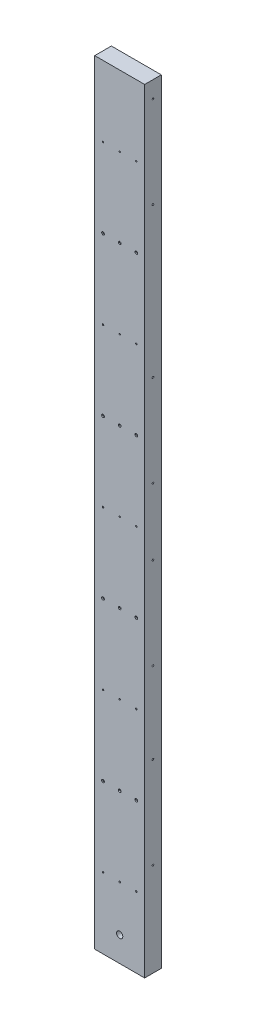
SolidWorks part; units mm, degrees
ref_plane "Front Plane" through (0, 0, 0) normal (0, 0, 1) x (1, 0, 0)
ref_plane "Top Plane" through (0, 0, 0) normal (0, 1, 0) x (1, 0, 0)
ref_plane "Right Plane" through (0, 0, 0) normal (1, 0, 0) x (0, 0, -1)
sketch "Sketch1" plane through (0, 0, 0) normal (0, 1, 0) x (1, 0, 0)
  line L1 (-76.2, 25.4) -> (76.2, 25.4)
  line L2 (-76.2, 25.4) -> (-76.2, -25.4)
  line L3 (-76.2, -25.4) -> (76.2, -25.4)
  line L4 (76.2, 25.4) -> (76.2, -25.4)
  line L5 (-76.2, 25.4) -> (76.2, -25.4) construction
  line L6 (-76.2, -25.4) -> (76.2, 25.4) construction
  point P0 (0, 0)
  dimension "D1" = 152.4
  dimension "D2" = 50.8
extrude "Boss-Extrude1" add sketch "Sketch1" along normal blind 2362.2
hole_wizard "3/4 (0.75) Diameter Slot1" positions "Sketch3" profile "Sketch2" size "3/4" standard "ANSI Inch"
sketch "Sketch3" plane through (0, 0, -25.4) normal (0, 0, -1) x (-1, 0, 0)
  line L0 (-76.2, 0) -> (76.2, 0) construction
  line L1 (76.2, 2362.2) -> (76.2, 0) construction
  point P0 (0, 76.2)
  dimension "D1" = 76.2
  dimension "D2" = 76.2
sketch "Sketch2" plane through (0, 76.2, -25.4) normal (1, 0, 0) x (0, 1, 0)
  line L0 (0, 0) -> (0, 50.8)
  line L1 (0, 50.8) -> (9.525, 50.8)
  line L2 (9.525, 50.8) -> (9.525, 0)
  line L5 (9.525, 0) -> (0, 0)
  line L11 (0, -6.35) -> (0, 107.95) construction
  dimension "Thru Hole Dia." = 19.05
  dimension "Thru Hole Depth" = 50.8
hole_wizard "3/4 (0.75) Diameter Slot2" positions "Sketch5" profile "Sketch4" size "3/4" standard "ANSI Inch"
sketch "Sketch5" plane through (0, 0, -25.4) normal (0, 0, -1) x (-1, 0, 0)
  line L0 (-76.2, 0) -> (76.2, 0) construction
  line L1 (76.2, 2362.2) -> (76.2, 0) construction
  point P0 (0, 76.2)
  dimension "D1" = 76.2
  dimension "D2" = 76.2
sketch "Sketch4" plane through (0, 76.2, -25.4) normal (1, 0, 0) x (0, 1, 0)
  line L0 (0, 0) -> (0, 50.8)
  line L1 (0, 50.8) -> (14.2875, 50.8)
  line L2 (14.2875, 50.8) -> (14.2875, 0)
  line L5 (14.2875, 0) -> (0, 0)
  line L11 (0, -6.35) -> (0, 107.95) construction
  dimension "Thru Hole Dia." = 28.575
  dimension "Thru Hole Depth" = 50.8
hole_wizard "CSK for #8 Flat Head Machine Screw (100)2" positions "Sketch9" profile "Sketch8" countersink size "#8" standard "ANSI Inch"
sketch "Sketch9"
  line L0 (0, 2362.2) -> (0, 0) construction
  line L1 (-76.2, 2362.2) -> (76.2, 2362.2) construction
  line L2 (-76.2, 0) -> (76.2, 0) construction
  line L4 (50.8, 2362.2) -> (50.8, 0) construction
  line L6 (-50.8, 0) -> (-50.8, 2362.2) construction
  line L8 (-76.2, 2362.2) -> (-76.2, 0) construction
  line L9 (76.2, 2362.2) -> (76.2, 0) construction
  line L10 (76.2, 1905) -> (-76.2, 1905) construction
  line L12 (76.2, 1422.4) -> (-76.2, 1422.4) construction
  line L14 (76.2, 939.8) -> (-76.2, 939.8) construction
  line L16 (76.2, 457.2) -> (-76.2, 457.2) construction
  point P0 (50.8, 1905)
  point P2 (0, 1905)
  point P4 (-50.8, 1905)
  point P6 (50.8, 1422.4)
  point P8 (0, 1422.4)
  point P10 (-50.8, 1422.4)
  point P12 (50.8, 939.8)
  point P14 (0, 939.8)
  point P16 (-50.8, 939.8)
  point P18 (50.8, 457.2)
  point P20 (0, 457.2)
  point P22 (-50.8, 457.2)
  dimension "D1" = 25.4
  dimension "D2" = 25.4
  dimension "D3" = 457.2
  dimension "D4" = 939.8
  dimension "D5" = 1422.4
  dimension "D6" = 1905
sketch "Sketch8" plane through (50.8, 1905, 25.4) normal (1, 0, 0) x (0, -1, 0)
  line L0 (0, 0) -> (0, 50.8)
  line L1 (0, 50.8) -> (2.2479, 50.8)
  line L2 (2.2479, 50.8) -> (2.2479, 1.6518)
  line L3 (2.2479, 1.6518) -> (4.2164, 0)
  line L5 (4.2164, 0) -> (0, 0)
  line L6 (-2.2479, 1.6518) -> (-4.2164, 0) construction
  line L11 (0, -6.35) -> (0, 107.95) construction
  dimension "Thru Hole Dia." = 4.4958
  dimension "Thru Hole Depth" = 50.8
  dimension "Near C'Sink Dia." = 8.4328
  dimension "Near C'Sink Angle" = 100
hole_wizard "CSK for #8 Flat Head Machine Screw (100)3" positions "Sketch11" profile "Sketch10" countersink size "#8" standard "ANSI Inch"
sketch "Sketch11" plane through (0, 0, -25.4) normal (0, 0, -1) x (-1, 0, 0)
  line L0 (0, 0) -> (0, 2362.2) construction
  line L1 (-76.2, 0) -> (76.2, 0) construction
  line L2 (-76.2, 2362.2) -> (76.2, 2362.2) construction
  line L6 (50.8, 2362.2) -> (50.8, 0) construction
  line L8 (-50.8, 0) -> (-50.8, 2362.2) construction
  line L10 (-76.2, 2146.3) -> (76.2, 2146.3) construction
  line L11 (-76.2, 2362.2) -> (-76.2, 0) construction
  line L12 (76.2, 2362.2) -> (76.2, 0) construction
  line L14 (-76.2, 1663.7) -> (76.2, 1663.7) construction
  line L16 (-76.2, 1181.1) -> (76.2, 1181.1) construction
  line L18 (-76.2, 698.5) -> (76.2, 698.5) construction
  line L20 (-76.2, 215.9) -> (76.2, 215.9) construction
  point P0 (-50.8, 2146.3)
  point P2 (0, 2146.3)
  point P4 (50.8, 2146.3)
  point P6 (-50.8, 1663.7)
  point P8 (0, 1663.7)
  point P10 (50.8, 1663.7)
  point P12 (-50.8, 1181.1)
  point P14 (0, 1181.1)
  point P16 (50.8, 1181.1)
  point P18 (-50.8, 698.5)
  point P20 (0, 698.5)
  point P22 (50.8, 698.5)
  point P24 (-50.8, 215.9)
  point P26 (0, 215.9)
  point P28 (50.8, 215.9)
  dimension "D1" = 25.4
  dimension "D2" = 25.4
  dimension "D3" = 215.9
  dimension "D4" = 698.5
  dimension "D5" = 1181.1
  dimension "D6" = 1663.7
  dimension "D7" = 2146.3
sketch "Sketch10" plane through (50.8, 2146.3, -25.4) normal (1, 0, 0) x (0, 1, 0)
  line L0 (0, 0) -> (0, 50.8)
  line L1 (0, 50.8) -> (2.2479, 50.8)
  line L2 (2.2479, 50.8) -> (2.2479, 1.6518)
  line L3 (2.2479, 1.6518) -> (4.2164, 0)
  line L5 (4.2164, 0) -> (0, 0)
  line L6 (-2.2479, 1.6518) -> (-4.2164, 0) construction
  line L11 (0, -6.35) -> (0, 107.95) construction
  dimension "Thru Hole Dia." = 4.4958
  dimension "Thru Hole Depth" = 50.8
  dimension "Near C'Sink Dia." = 8.4328
  dimension "Near C'Sink Angle" = 100
hole_wizard "CSK for #8 Flat Head Machine Screw (100)4" positions "Sketch13" profile "Sketch12" countersink size "#8" standard "ANSI Inch"
sketch "Sketch13" plane through (0, 0, 25.4) normal (0, 0, 1) x (1, 0, 0)
  line L0 (-76.2, 2362.2) -> (-76.2, 0) construction
  line L1 (-76.2, 1181.1) -> (76.2, 1181.1) construction
  line L2 (76.2, 2362.2) -> (76.2, 0) construction
  point P0 (-57.15, 1209.675)
  point P2 (-57.15, 1152.525)
  dimension "D1" = 19.05
  dimension "D2" = 19.05
  dimension "D3" = 28.575
  dimension "D4" = 28.575
sketch "Sketch12" plane through (-57.15, 1209.675, 25.4) normal (1, 0, 0) x (0, -1, 0)
  line L0 (0, 0) -> (0, 50.8)
  line L1 (0, 50.8) -> (2.2479, 50.8)
  line L2 (2.2479, 50.8) -> (2.2479, 1.6518)
  line L3 (2.2479, 1.6518) -> (4.2164, 0)
  line L5 (4.2164, 0) -> (0, 0)
  line L6 (-2.2479, 1.6518) -> (-4.2164, 0) construction
  line L11 (0, -6.35) -> (0, 107.95) construction
  dimension "Thru Hole Dia." = 4.4958
  dimension "Thru Hole Depth" = 50.8
  dimension "Near C'Sink Dia." = 8.4328
  dimension "Near C'Sink Angle" = 100
hole_wizard "CSK for #8 Flat Head Machine Screw (100)6" positions "Sketch17" profile "Sketch16" countersink size "#8" standard "ANSI Inch"
sketch "Sketch17" plane through (0, 0, 19.05) normal (0, 0, 1) x (1, 0, 0)
  line L0 (-69.85, 2362.2) -> (-69.85, 0) construction
  line L1 (-69.85, 0) -> (-69.85, 215.9) construction
  line L3 (-69.85, 215.9) -> (69.85, 215.9) construction
  line L4 (69.85, 2362.2) -> (69.85, 0) construction
  point P0 (-50.8, 190.5)
  point P2 (-50.8, 241.3)
  dimension "D1" = 19.05
  dimension "D2" = 19.05
  dimension "D3" = 215.9
  dimension "D4" = 25.4
  dimension "D5" = 25.4
sketch "Sketch16" plane through (-50.8, 190.5, 19.05) normal (1, 0, 0) x (0, -1, 0)
  line L0 (0, 0) -> (0, 38.1)
  line L1 (0, 38.1) -> (2.2479, 38.1)
  line L2 (2.2479, 38.1) -> (2.2479, 1.6518)
  line L3 (2.2479, 1.6518) -> (4.2164, 0)
  line L5 (4.2164, 0) -> (0, 0)
  line L6 (-2.2479, 1.6518) -> (-4.2164, 0) construction
  line L11 (0, -6.35) -> (0, 107.95) construction
  dimension "Thru Hole Dia." = 4.4958
  dimension "Thru Hole Depth" = 38.1
  dimension "Near C'Sink Dia." = 8.4328
  dimension "Near C'Sink Angle" = 100
hole_wizard "#10 (0.1935) Diameter Hole1" positions "Sketch18" profile "Sketch19" hole size "#10" standard "ANSI Inch"
sketch "Sketch18" plane through (1122.9572, 4003.7671, 25.4) normal (0, 0, 1) x (0, 1, 0)
  line L1 (-4003.7671, 1199.1572) -> (-4003.7671, 1046.7572) construction
  point P0 (-2403.5671, 1134.8635)
  point P4 (-2403.5671, 1111.051)
  point P7 (-2263.8671, 1134.8635)
  point P10 (-2263.8671, 1111.051)
  point P13 (-3394.1671, 1134.8635)
  point P16 (-3394.1671, 1111.051)
  point P19 (-3254.4671, 1134.8635)
  point P22 (-3254.4671, 1111.051)
  dimension "D1" = 139.7
  dimension "D2" = 609.6
sketch "Sketch19" plane through (-11.9062, 1600.2, 25.4) normal (1, 0, 0) x (0, -1, 0)
  line L0 (0, 0) -> (0, 52.2756)
  line L1 (0, 52.2756) -> (2.4574, 50.799)
  line L2 (2.4574, 50.799) -> (2.4574, 0)
  line L3 (2.4574, 0) -> (0, 0)
  line L4 (0, 52.2756) -> (-2.4575, 50.799) construction
  line L5 (0, -6.35) -> (0, 107.95) construction
  dimension "Hole Dia." = 4.9149
  dimension "Hole Depth" = 50.799
  dimension "Drill Angle" = 118
hole_wizard "1/4 (0.25) Diameter Hole1" positions "Sketch20" profile "Sketch21" hole size "1/4" standard "ANSI Inch"
sketch "Sketch20" plane through (-1122.9572, 4003.7671, 76.2) normal (0, 0, 1) x (0, -1, 0)
  line L0 (1641.5671, 1046.7572) -> (1641.5671, 1199.1572) construction
  line L1 (4003.7671, 1046.7572) -> (4003.7671, 1199.1572) construction
  point P0 (1844.7671, 1129.3072)
  point P3 (1844.7671, 1103.9072)
  point P6 (1901.9171, 1103.9072)
  point P9 (1901.9171, 1129.3072)
  point P12 (2378.1671, 1129.3072)
  point P15 (2378.1671, 1103.9072)
  point P18 (2321.0171, 1129.3072)
  point P21 (2321.0171, 1103.9072)
  point P24 (3381.4671, 1129.3072)
  point P27 (3381.4671, 1103.9072)
  point P30 (3324.3171, 1103.9072)
  point P33 (3324.3171, 1129.3072)
  point P36 (3743.4171, 1103.9072)
  point P39 (3743.4171, 1129.3072)
  point P42 (3800.5671, 1129.3072)
  point P45 (3800.5671, 1103.9072)
  dimension "D1" = 203.2
  dimension "D2" = 203.2
  dimension "D3" = 419.1
  dimension "D4" = 57.15
  dimension "D5" = 419.1
  dimension "D6" = 57.15
  dimension "D7" = 57.15
sketch "Sketch21" plane through (6.35, 2159, 76.2) normal (1, 0, 0) x (0, -1, 0)
  line L0 (0, 0) -> (0, 103.5067)
  line L1 (0, 103.5067) -> (3.175, 101.599)
  line L2 (3.175, 101.599) -> (3.175, 0)
  line L3 (3.175, 0) -> (0, 0)
  line L4 (0, 103.5067) -> (-3.175, 101.599) construction
  line L5 (0, -6.35) -> (0, 107.95) construction
  dimension "Hole Dia." = 6.35
  dimension "Hole Depth" = 101.599
  dimension "Drill Angle" = 118
sketch "Sketch22" plane through (76.2, 1803.4, -1193.8) normal (1, 0, 0) x (0, 0, -1)
  line L0 (-1219.2, -508) -> (355.6, -508) construction
  line L5 (-1193.8, 609.6) -> (-1193.8, -609.6) construction
  line L8 (330.2, 609.6) -> (330.2, -609.6) construction
  line L10 (-1219.2, 508) -> (355.6, 508) construction
  line L14 (-1219.2, 228.6) -> (355.6, 228.6) construction
  line L16 (-1219.2, -228.6) -> (355.6, -228.6) construction
  line L18 (-1219.2, -479.425) -> (355.6, -479.425) construction
  point P0 (-1193.8, -508)
  point P2 (-685.8, -508)
  point P4 (-177.8, -508)
  point P6 (330.2, -508)
  point P8 (-1193.8, 508)
  point P12 (-1193.8, 228.6)
  point P14 (-1193.8, -228.6)
  point P20 (330.2, -228.6)
  point P22 (330.2, 0)
  point P26 (330.2, 508)
sketch "Sketch23" plane through (76.2, 584.2, -1193.8) normal (1, 0, 0) x (0, 0, -1)
  line L0 (-1193.8, 609.6) -> (-1193.8, -400.05) construction
  line L4 (-1219.2, 508) -> (355.6, 508) construction
  line L8 (330.2, 609.6) -> (330.2, -400.05) construction
  line L10 (-1219.2, -298.45) -> (355.6, -298.45) construction
  line L14 (-1219.2, 228.6) -> (355.6, 228.6) construction
  line L16 (-1219.2, -19.05) -> (355.6, -19.05) construction
  point P2 (-1193.8, 228.6)
  point P4 (-1193.8, -19.05)
  point P10 (330.2, -19.05)
  point P12 (330.2, 228.6)
  point P16 (-1193.8, 508)
  point P18 (-685.8, 508)
  point P20 (-177.8, 508)
  point P22 (330.2, 508)
  point P24 (-1193.8, -298.45)
  point P26 (-685.8, -298.45)
  point P28 (-177.8, -298.45)
  point P30 (330.2, -298.45)
sketch "Sketch24" [suppressed] plane through (-76.2, 1803.4, 685.8) normal (-1, 0, 0) x (0, 0, 1)
  line L0 (-1219.2, -508) -> (355.6, -508) construction
  line L5 (-1193.8, 609.6) -> (-1193.8, -609.6) construction
  line L8 (330.2, 609.6) -> (330.2, -609.6) construction
  line L10 (-1219.2, 508) -> (355.6, 508) construction
  line L14 (-1219.2, 228.6) -> (355.6, 228.6) construction
  line L16 (-1219.2, -228.6) -> (355.6, -228.6) construction
  line L18 (-1219.2, -479.425) -> (355.6, -479.425) construction
  point P0 (-1193.8, -508)
  point P2 (-685.8, -508)
  point P4 (-177.8, -508)
  point P6 (330.2, -508)
  point P8 (-1193.8, 508)
  point P12 (-1193.8, 228.6)
  point P14 (-1193.8, -228.6)
  point P20 (330.2, -228.6)
  point P22 (330.2, 0)
  point P26 (330.2, 508)
sketch "Sketch25" [suppressed] plane through (76.2, 0, 0) normal (1, 0, 0) x (0, 0, -1)
  line L0 (533.4, 2311.4) -> (-1041.4, 2311.4) construction
  point P0 (0, 2311.4)
  point P1 (1167.4048, 1887.8709)
  point P6 (0, 1295.4)
sketch "Sketch26" [suppressed] plane through (-76.2, 584.2, 685.8) normal (-1, 0, 0) x (0, 0, 1)
  line L0 (-1193.8, 609.6) -> (-1193.8, -400.05) construction
  line L4 (-1219.2, 508) -> (355.6, 508) construction
  line L8 (330.2, 609.6) -> (330.2, -400.05) construction
  line L10 (-1219.2, -298.45) -> (355.6, -298.45) construction
  line L14 (-1219.2, 228.6) -> (355.6, 228.6) construction
  line L16 (-1219.2, -19.05) -> (355.6, -19.05) construction
  point P2 (-1193.8, 228.6)
  point P4 (-1193.8, -19.05)
  point P10 (330.2, -19.05)
  point P12 (330.2, 228.6)
  point P16 (-1193.8, 508)
  point P18 (-685.8, 508)
  point P20 (-177.8, 508)
  point P22 (330.2, 508)
  point P24 (-1193.8, -298.45)
  point P26 (-685.8, -298.45)
  point P28 (-177.8, -298.45)
  point P30 (330.2, -298.45)
sketch "Sketch27" plane through (76.2, 1803.4, -177.8) normal (1, 0, 0) x (0, 0, -1)
  line L0 (-1219.2, -508) -> (355.6, -508) construction
  line L5 (-1193.8, 609.6) -> (-1193.8, -609.6) construction
  line L8 (330.2, 609.6) -> (330.2, -609.6) construction
  line L10 (-1219.2, 508) -> (355.6, 508) construction
  line L14 (-1219.2, 228.6) -> (355.6, 228.6) construction
  line L16 (-1219.2, -228.6) -> (355.6, -228.6) construction
  line L18 (-1219.2, -479.425) -> (355.6, -479.425) construction
  point P0 (-1193.8, -508)
  point P2 (-685.8, -508)
  point P4 (-177.8, -508)
  point P6 (330.2, -508)
  point P8 (-1193.8, 508)
  point P12 (-1193.8, 228.6)
  point P14 (-1193.8, -228.6)
  point P20 (330.2, -228.6)
  point P22 (330.2, 0)
  point P26 (330.2, 508)
sketch "Sketch28" plane through (76.2, 0, 0) normal (1, 0, 0) x (0, 0, -1)
  line L0 (-1041.4, 2311.4) -> (533.4, 2311.4) construction
  point P0 (0, 1295.4)
  point P1 (0, 2311.4)
sketch "Sketch29" plane through (76.2, 584.2, -177.8) normal (1, 0, 0) x (0, 0, -1)
  line L0 (-1193.8, 609.6) -> (-1193.8, -400.05) construction
  line L4 (-1219.2, 508) -> (355.6, 508) construction
  line L8 (330.2, 609.6) -> (330.2, -400.05) construction
  line L10 (-1219.2, -298.45) -> (355.6, -298.45) construction
  line L14 (-1219.2, 228.6) -> (355.6, 228.6) construction
  line L16 (-1219.2, -19.05) -> (355.6, -19.05) construction
  point P2 (-1193.8, 228.6)
  point P4 (-1193.8, -19.05)
  point P10 (330.2, -19.05)
  point P12 (330.2, 228.6)
  point P16 (-1193.8, 508)
  point P18 (-685.8, 508)
  point P20 (-177.8, 508)
  point P22 (330.2, 508)
  point P24 (-1193.8, -298.45)
  point P26 (-685.8, -298.45)
  point P28 (-177.8, -298.45)
  point P30 (330.2, -298.45)
sketch "Sketch30" [suppressed] plane through (-76.2, 1803.4, -330.2) normal (-1, 0, 0) x (0, 0, 1)
  line L0 (-1219.2, -508) -> (355.6, -508) construction
  line L5 (-1193.8, 609.6) -> (-1193.8, -609.6) construction
  line L8 (330.2, 609.6) -> (330.2, -609.6) construction
  line L10 (-1219.2, 508) -> (355.6, 508) construction
  line L14 (-1219.2, 228.6) -> (355.6, 228.6) construction
  line L16 (-1219.2, -228.6) -> (355.6, -228.6) construction
  line L18 (-1219.2, -479.425) -> (355.6, -479.425) construction
  point P0 (-1193.8, -508)
  point P2 (-685.8, -508)
  point P4 (-177.8, -508)
  point P6 (330.2, -508)
  point P8 (-1193.8, 508)
  point P12 (-1193.8, 228.6)
  point P14 (-1193.8, -228.6)
  point P20 (330.2, -228.6)
  point P22 (330.2, 0)
  point P26 (330.2, 508)
sketch "Sketch31" [suppressed] plane through (-76.2, 584.2, -330.2) normal (-1, 0, 0) x (0, 0, 1)
  line L0 (-1193.8, 609.6) -> (-1193.8, -400.05) construction
  line L4 (-1219.2, 508) -> (355.6, 508) construction
  line L8 (330.2, 609.6) -> (330.2, -400.05) construction
  line L10 (-1219.2, -298.45) -> (355.6, -298.45) construction
  line L14 (-1219.2, 228.6) -> (355.6, 228.6) construction
  line L16 (-1219.2, -19.05) -> (355.6, -19.05) construction
  point P2 (-1193.8, 228.6)
  point P4 (-1193.8, -19.05)
  point P10 (330.2, -19.05)
  point P12 (330.2, 228.6)
  point P16 (-1193.8, 508)
  point P18 (-685.8, 508)
  point P20 (-177.8, 508)
  point P22 (330.2, 508)
  point P24 (-1193.8, -298.45)
  point P26 (-685.8, -298.45)
  point P28 (-177.8, -298.45)
  point P30 (330.2, -298.45)
hole_wizard "#8 (0.199) Diameter Hole2" positions "3DSketch1" profile "Sketch36" hole size "#8" standard "ANSI Inch"
sketch3d "3DSketch1"
  point P0 (76.2, 285.75, 0)
  point P3 (76.2, 565.15, 0)
  point P6 (76.2, 812.8, 0)
  point P9 (76.2, 1092.2, 0)
  point P12 (76.2, 2311.4, 0)
  point P15 (76.2, 2032, 0)
  point P18 (76.2, 1574.8, 0)
  point P21 (76.2, 1295.4, 0)
sketch "Sketch36" plane through (76.2, 285.75, 0) normal (0, 1, 0) x (0, 0, -1)
  line L0 (0, 0) -> (0, 26.9186)
  line L1 (0, 26.9186) -> (2.5273, 25.4)
  line L2 (2.5273, 25.4) -> (2.5273, 0)
  line L5 (2.5273, 0) -> (0, 0)
  line L10 (0, 26.9186) -> (-2.5273, 25.4) construction
  line L11 (0, -6.35) -> (0, 107.95) construction
  dimension "Hole Dia." = 5.0546
  dimension "Hole Depth" = 25.4
  dimension "Drill Angle" = 118
sketch "Sketch37" [suppressed] plane through (-76.2, 0, 0) normal (-1, 0, 0) x (0, 0, 1)
  point P0 (0, 285.75)
  point P2 (0, 565.15)
  point P4 (0, 812.8)
  point P6 (0, 1092.2)
  point P8 (0, 1295.4)
  point P10 (0, 1574.8)
  point P12 (0, 2032)
  point P14 (0, 2311.4)
hole_wizard "#8 (0.199) Diameter Hole3" positions "Sketch38" profile "Sketch39" hole size "#8" standard "ANSI Inch"
sketch "Sketch38" plane through (-76.2, 0, 0) normal (-1, 0, 0) x (0, 0, 1)
  point P0 (0, 285.75)
  point P3 (0, 565.15)
  point P6 (0, 812.8)
  point P9 (0, 1092.2)
  point P12 (0, 1295.4)
  point P15 (0, 1574.8)
  point P18 (0, 2032)
  point P21 (0, 2311.4)
sketch "Sketch39" plane through (-76.2, 285.75, 0) normal (0, 1, 0) x (0, 0, 1)
  line L0 (0, 0) -> (0, 26.9186)
  line L1 (0, 26.9186) -> (2.5273, 25.4)
  line L2 (2.5273, 25.4) -> (2.5273, 0)
  line L5 (2.5273, 0) -> (0, 0)
  line L10 (0, 26.9186) -> (-2.5273, 25.4) construction
  line L11 (0, -6.35) -> (0, 107.95) construction
  dimension "Hole Dia." = 5.0546
  dimension "Hole Depth" = 25.4
  dimension "Drill Angle" = 118
sketch "Sketch40" [suppressed] plane through (-76.2, 2317.75, 25.4) normal (0, 0, 1) x (0, -1, 0)
  point P0 (-31.75, 25.4)
  point P2 (31.75, 25.4)
  point P4 (-31.75, 114.3)
  point P6 (31.75, 114.3)
sketch "Sketch41" [suppressed] plane through (-76.1594, 2130.425, 25.4) normal (0, 0, 1) x (0, -1, 0)
  point P0 (-31.75, 25.4)
  point P2 (31.75, 25.4)
  point P4 (-31.75, 114.3)
  point P6 (31.75, 114.3)
sketch "Sketch42" [suppressed] plane through (76.2, 2317.75, 25.4) normal (0, 0, 1) x (0, 1, 0)
  point P0 (-31.75, 25.4)
  point P2 (31.75, 25.4)
  point P4 (-31.75, 114.3)
  point P6 (31.75, 114.3)
sketch "Sketch43" [suppressed] plane through (76.2, 2139.95, 25.4) normal (0, 0, 1) x (0, 1, 0)
  point P0 (-31.75, 25.4)
  point P2 (31.75, 25.4)
  point P4 (-31.75, 114.3)
  point P6 (31.75, 114.3)
hole_wizard "#8 (0.199) Diameter Hole5" positions "Sketch46" profile "Sketch47" hole size "#8" standard "ANSI Inch"
sketch "Sketch46" plane through (0, 0, 25.4) normal (0, 0, 1) x (1, 0, 0)
  point P0 (-38.1, 2349.5)
  point P5 (-38.1, 2286)
  point P8 (50.8, 2286)
  point P11 (-38.1, 2171.7)
  point P14 (50.8, 2171.7)
  point P17 (-38.1, 2108.2)
  point P20 (50.8, 2108.2)
  point P25 (50.8, 2349.5)
sketch "Sketch47" plane through (-38.1, 2349.5, 25.4) normal (1, 0, 0) x (0, -1, 0)
  line L0 (0, 0) -> (0, 26.9186)
  line L1 (0, 26.9186) -> (2.5273, 25.4)
  line L2 (2.5273, 25.4) -> (2.5273, 0)
  line L5 (2.5273, 0) -> (0, 0)
  line L10 (0, 26.9186) -> (-2.5273, 25.4) construction
  line L11 (0, -6.35) -> (0, 107.95) construction
  dimension "Hole Dia." = 5.0546
  dimension "Hole Depth" = 25.4
  dimension "Drill Angle" = 118
hole_wizard "#8 (0.199) Diameter Hole6" positions "Sketch48" profile "Sketch49" hole size "#8" standard "ANSI Inch"
sketch "Sketch48" plane through (0, 0, 25.4) normal (0, 0, 1) x (1, 0, 0)
  point P0 (-50.8, 2349.5)
  point P3 (38.1, 2349.5)
  point P6 (-50.8, 2286)
  point P9 (38.1, 2286)
  point P12 (-50.7594, 2162.175)
  point P15 (38.1406, 2162.175)
  point P18 (38.1406, 2098.675)
  point P21 (-50.7594, 2098.675)
sketch "Sketch49" plane through (-50.8, 2349.5, 25.4) normal (1, 0, 0) x (0, -1, 0)
  line L0 (0, 0) -> (0, 26.9186)
  line L1 (0, 26.9186) -> (2.5273, 25.4)
  line L2 (2.5273, 25.4) -> (2.5273, 0)
  line L5 (2.5273, 0) -> (0, 0)
  line L10 (0, 26.9186) -> (-2.5273, 25.4) construction
  line L11 (0, -6.35) -> (0, 107.95) construction
  dimension "Hole Dia." = 5.0546
  dimension "Hole Depth" = 25.4
  dimension "Drill Angle" = 118
